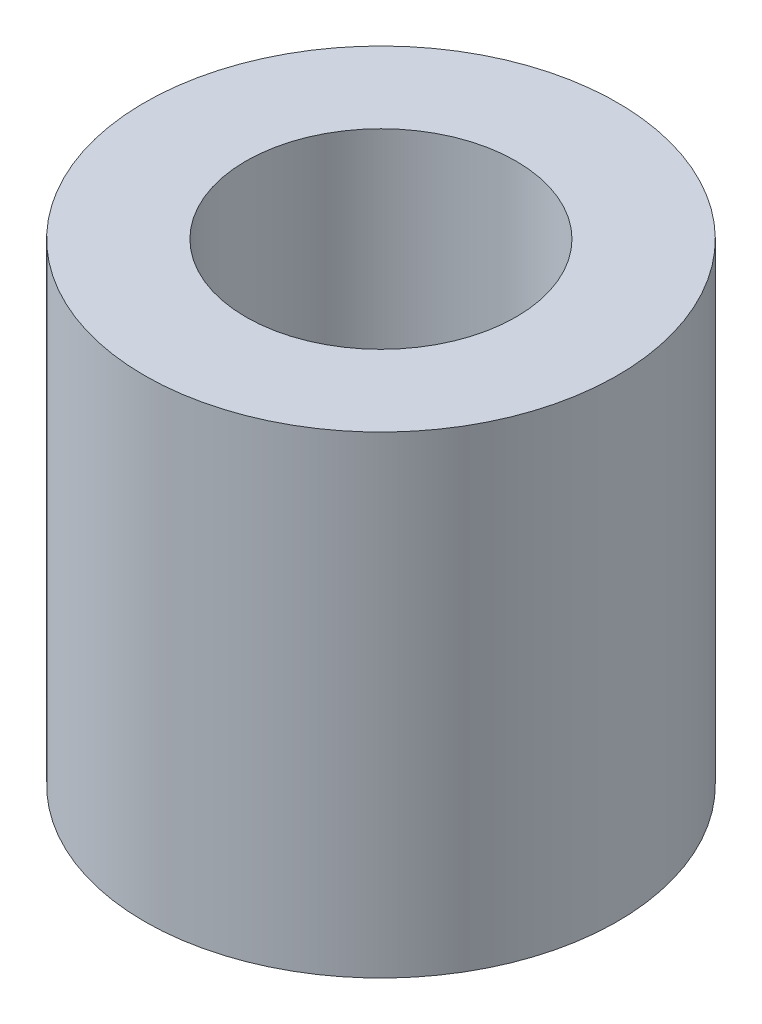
SolidWorks part; units mm, degrees
ref_plane "Front Plane" through (0, 0, 0) normal (0, 0, 1) x (1, 0, 0)
ref_plane "Top Plane" through (0, 0, 0) normal (0, 1, 0) x (1, 0, 0)
ref_plane "Right Plane" through (0, 0, 0) normal (1, 0, 0) x (0, 0, -1)
sketch "Sketch1" plane through (0, 0, 0) normal (0, 1, 0) x (1, 0, 0)
  circle A0 centre (0, 0) radius 100
  circle A1 centre (0, 0) radius 175
  dimension "D1" = 200
  dimension "D2" = 350
extrude "Boss-Extrude1" add sketch "Sketch1" along normal blind 350
